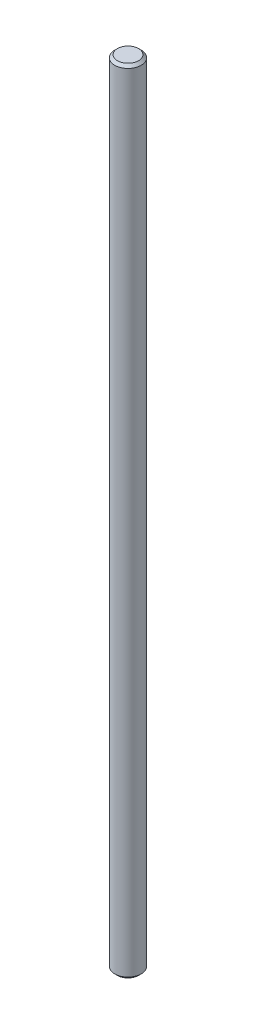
SolidWorks part; units mm, degrees
ref_plane "Front Plane" through (0, 0, 0) normal (0, 0, 1) x (1, 0, 0)
ref_plane "Top Plane" through (0, 0, 0) normal (0, 1, 0) x (1, 0, 0)
ref_plane "Right Plane" through (0, 0, 0) normal (1, 0, 0) x (0, 0, -1)
sketch "Sketch1" plane through (0, 0, 0) normal (0, 1, 0) x (1, 0, 0)
  circle A0 centre (0, 0) radius 2
  dimension "D1" = 4
extrude "Extrude1" add sketch "Sketch1" along normal blind 120
chamfer "Chamfer1" distance 0.4 angle 45 2 edges at (0, 0, 2) (0, 120, 2)
